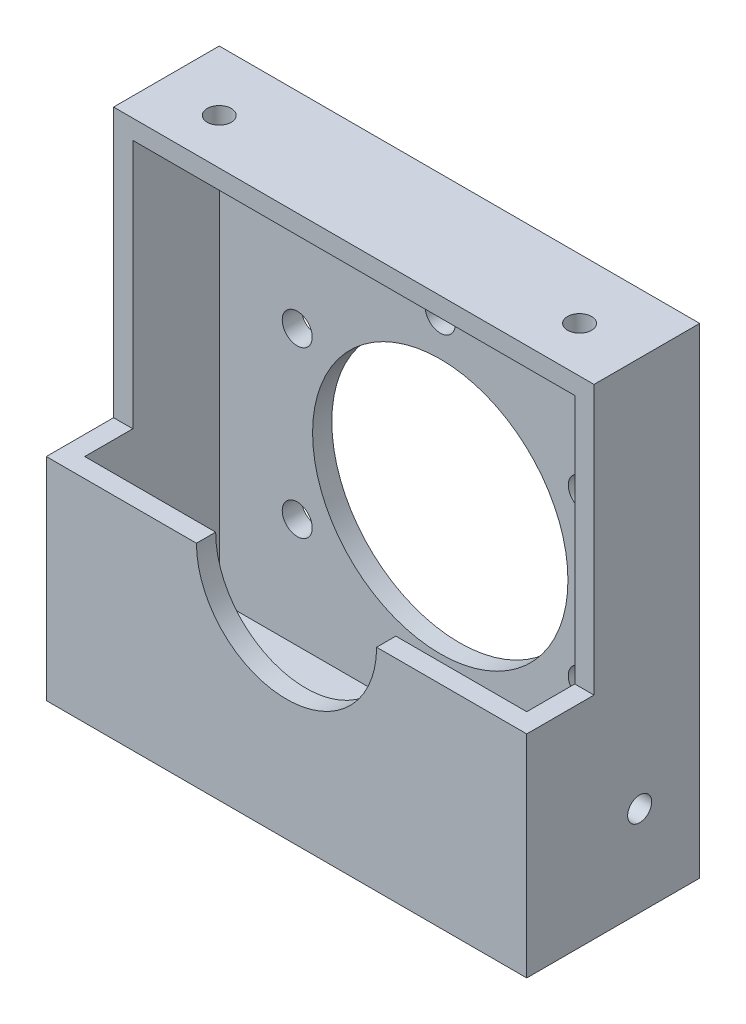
SolidWorks part; units mm, degrees
ref_plane "Front" through (0, 0, 0) normal (0, 0, 1) x (1, 0, 0)
ref_plane "Top" through (0, 0, 0) normal (0, 1, 0) x (1, 0, 0)
ref_plane "Right" through (0, 0, 0) normal (1, 0, 0) x (0, 0, -1)
sketch "Sketch1" plane through (0, 0, 0) normal (0, 0, 1) x (1, 0, 0)
  line L0 (0, 0) -> (50.8, 0)
  line L1 (0, 0) -> (0, 50.8)
  line L2 (50.8, 50.8) -> (0, 50.8)
  line L3 (50.8, 50.8) -> (50.8, 0)
  dimension "D1" = 50.8
extrude "main body" add sketch "Sketch1" along normal blind 18.288
sketch "Sketch2" plane through (50.8, 0, 0) normal (1, 0, 0) x (0, 0, -1)
  line L0 (-18.288, 50.8) -> (-11.176, 50.8)
  line L1 (-18.288, 50.8) -> (-18.288, 22.352)
  line L2 (-11.176, 22.352) -> (-18.288, 22.352)
  line L3 (-11.176, 22.352) -> (-11.176, 50.8)
  line L4 (-18.288, 0) -> (0, 0) construction
  line L5 (0, 50.8) -> (0, 0) construction
  dimension "D1" = 22.352
  dimension "D2" = 11.176
extrude "front cut" cut sketch "Sketch2" against normal through all
shell "Shell1" thickness 2.032
sketch "Sketch3" plane through (0, 0, 0) normal (0, 0, 1) x (1, 0, 0)
  line L0 (0, 22.352) -> (50.8, 22.352) construction
  circle A0 centre (25.4, 22.352) radius 13.5001
  dimension "D1" = 27.0002
extrude "center hole" cut sketch "Sketch3" along normal up to next
fillet "fill060.vert" radius 1.524
fillet "fill060.tb" radius 1.524
chamfer "cham025" distance 0.635 angle 45
sketch "Sketch4" plane through (0, 50.8, 0) normal (0, 1, 0) x (-1, 0, 0)
  line L0 (0, 6.35) -> (-50.8, 6.35) construction
  line L1 (0, 11.176) -> (0, 0) construction
  line L2 (-50.8, 11.176) -> (-50.8, 0) construction
  line L3 (-50.8, 0) -> (0, 0) construction
  line L4 (-25.4, 6.35) -> (-25.4, 0) construction
  line L5 (-25.4, 0) -> (-25.4, 2.032) construction
  circle A0 centre (-44.45, 6.35) radius 1.27
  circle A1 centre (-6.35, 6.35) radius 1.27
  dimension "D2" = 2.54
  dimension "D1" = 6.35
  dimension "D3" = 38.1
extrude "drill010.top" cut sketch "Sketch4" against normal up to next
sketch "Sketch6" plane through (50.8, 0, 0) normal (1, 0, 0) x (0, 0, -1)
  line L0 (-6.35, 50.8) -> (-6.35, 0) construction
  line L1 (-6.35, 48.768) -> (-6.35, 50.8) construction
  line L2 (-11.176, 50.8) -> (0, 50.8) construction
  line L3 (-18.288, 0) -> (0, 0) construction
  circle A0 centre (-6.35, 9.525) radius 1.27
  dimension "D1" = 2.54
  dimension "D2" = 9.525
extrude "drill010.sides" cut sketch "Sketch6" against normal through all
sketch "Sketch9" plane through (0, 0, 0) normal (0, 0, -1) x (-1, 0, 0)
  line L0 (-25.4, 22.352) -> (0, 22.352) construction
  line L1 (-25.4, 22.352) -> (0, 37.0167) construction
  line L2 (0, 0) -> (0, 50.8) construction
  circle A0 centre (-25.4, 22.352) radius 17.4625 construction
  circle A1 centre (-10.277, 31.0833) radius 1.5875
  dimension "D1" = 34.925
  dimension "D3" = 3.175
  dimension "D2" = 30
extrude "drill125" cut sketch "Sketch9" against normal up to next
pattern_circular "hole pattern" count 6 every 60 about axis through (25.4, 22.352, 0) along (0, 0, 1) of "drill125"
sketch "Sketch10" plane through (0, 0, 18.288) normal (0, 0, 1) x (1, 0, 0)
  line L0 (0, 22.352) -> (50.8, 22.352) construction
  circle A0 centre (25.4, 22.352) radius 9.525
  dimension "D1" = 19.05
extrude "step cut" cut sketch "Sketch10" against normal through all
